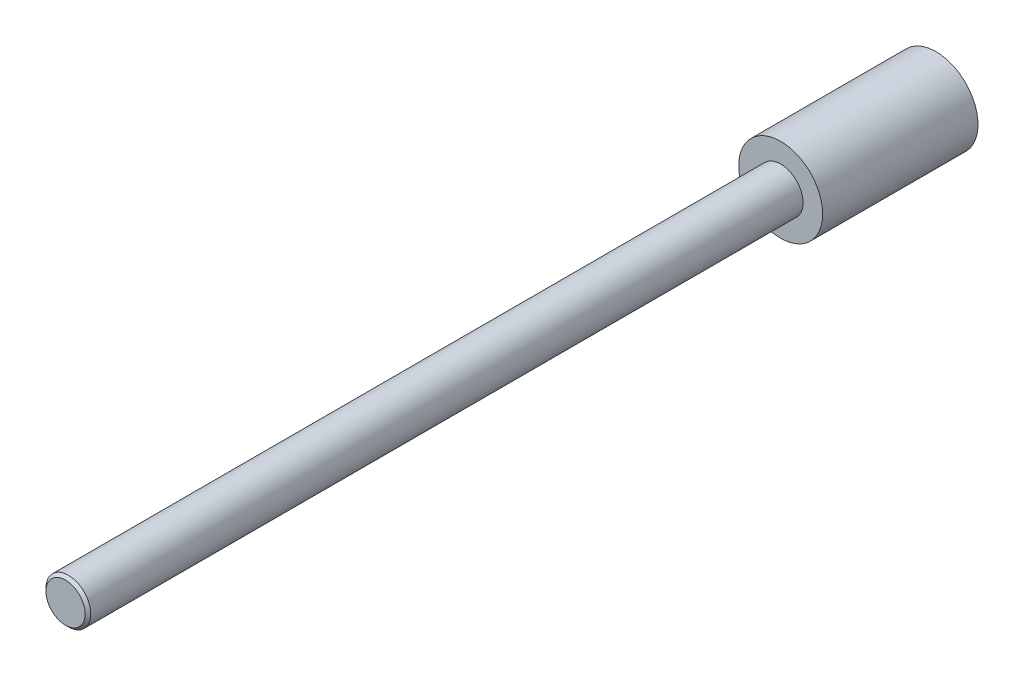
SolidWorks part; units mm, degrees
ref_plane "Front" through (0, 0, 0) normal (0, 0, 1) x (1, 0, 0)
ref_plane "Top" through (0, 0, 0) normal (0, 1, 0) x (1, 0, 0)
ref_plane "Right" through (0, 0, 0) normal (1, 0, 0) x (0, 0, -1)
ref_plane "Shaft Plane 1" through (0, 0, -0.254) normal (0, 0, 1) x (1, 0, 0)
sketch "Sketch1" plane through (0, 0, 0) normal (0, 0, 1) x (1, 0, 0)
  circle A0 centre (0, 0) radius 2.032
  dimension "活塞杆径" = 4.064
extrude "Base-Extrude" add sketch "Sketch1" along normal blind 78.74
sketch "Sketch2" plane through (0, 0, -0.254) normal (0, 0, 1) x (1, 0, 0)
  circle A0 centre (0, 0) radius 3.81
  dimension "活塞径" = 7.62
extrude "Boss-Extrude1" add sketch "Sketch2" along normal blind 14.097
chamfer "Chamfer1" distance 0.254 angle 45 1 edges at (2.032, 0, 78.74)
